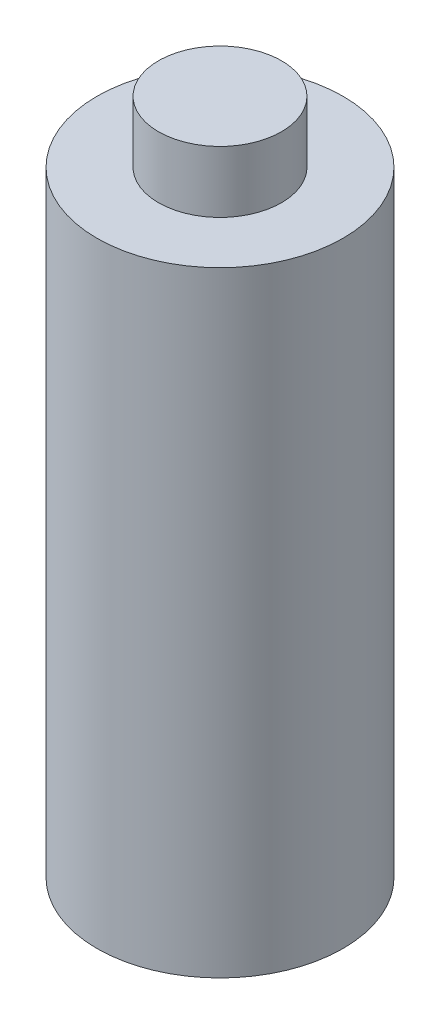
SolidWorks part; units mm, degrees
ref_plane "Plan de face" through (0, 0, 0) normal (0, 0, 1) x (1, 0, 0)
ref_plane "Plan de dessus" through (0, 0, 0) normal (0, 1, 0) x (1, 0, 0)
ref_plane "Plan de droite" through (0, 0, 0) normal (1, 0, 0) x (0, 0, -1)
sketch "Esquisse1" plane through (0, 0, 0) normal (0, 1, 0) x (1, 0, 0)
  circle A0 centre (0, 0) radius 40
extrude "Boss.-Extru.1" add sketch "Esquisse1" along normal blind 200
sketch "Esquisse2" plane through (0, 200, 0) normal (0, 1, 0) x (1, 0, 0)
  circle A0 centre (0, 0) radius 20
extrude "Boss.-Extru.2" add sketch "Esquisse2" along normal blind 20
